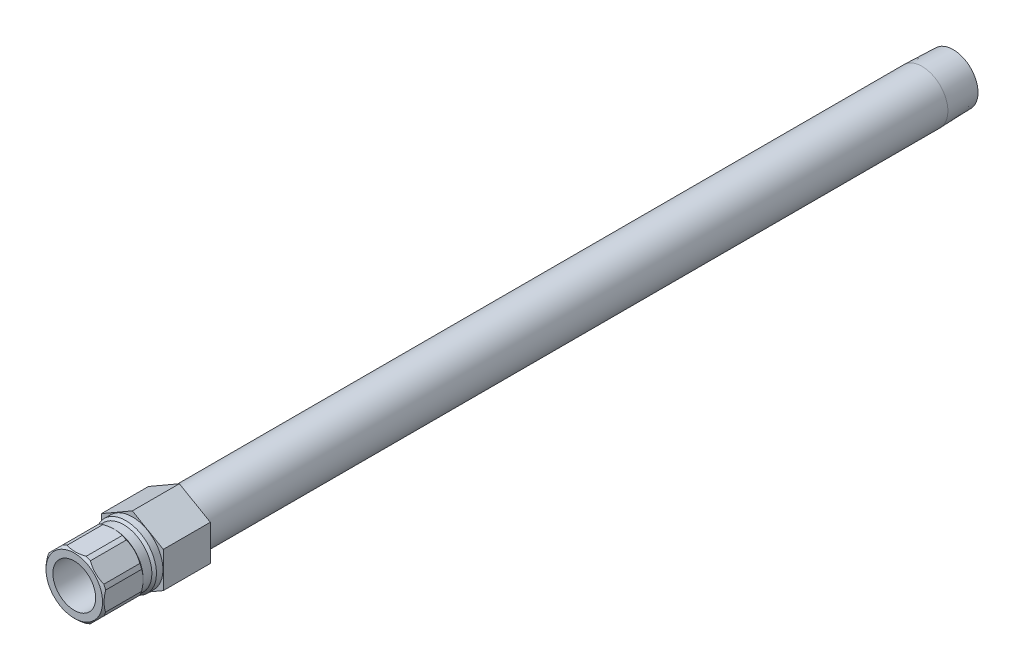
SolidWorks part; units mm, degrees
ref_plane "Front Plane" through (0, 0, 0) normal (0, 0, 1) x (1, 0, 0)
ref_plane "Top Plane" through (0, 0, 0) normal (0, 1, 0) x (1, 0, 0)
ref_plane "Right Plane" through (0, 0, 0) normal (1, 0, 0) x (0, 0, -1)
sketch "Sketch1" plane through (0, 0, 0) normal (1, 0, 0) x (0, 0, -1)
  line L0 (0, 0) -> (-22.479, 0) construction
  line L1 (-19.304, 7.112) -> (-19.304, 9.398)
  line L2 (-5.8166, 9.398) -> (-5.8166, 0) construction
  line L3 (-18.542, 10.16) -> (-6.5786, 10.16)
  line L4 (0, 8.5725) -> (0, 0) construction
  line L5 (-5.8166, 9.398) -> (-2.921, 9.398)
  line L6 (-2.159, 10.16) -> (0, 10.16)
  line L7 (0, 10.16) -> (0, 8.5725)
  line L8 (-5.8166, 9.398) -> (-6.5786, 10.16)
  line L9 (-2.921, 9.398) -> (-2.159, 10.16)
  line L10 (-19.304, 9.398) -> (-18.542, 10.16)
  line L11 (-19.304, 7.112) -> (-1.524, 7.112)
  line L12 (0, 8.5725) -> (262.4582, 8.5725)
  line L13 (262.4582, 8.5725) -> (272.796, 8.2494)
  line L14 (272.796, 8.2494) -> (272.796, 6.2611)
  line L15 (0, 10.16) -> (15.621, 10.16) construction
  line L16 (15.621, 10.16) -> (15.621, 7.112) construction
  line L17 (9.271, 0) -> (0, 0) construction
  line L18 (-1.524, 7.112) -> (-0.6731, 6.2611)
  line L19 (-0.6731, 6.2611) -> (272.796, 6.2611)
  dimension "D1" = 19.304
  dimension "D2" = 2.8956
  dimension "D3" = 0.762
  dimension "D4" = 45
  dimension "D5" = 13.4874
  dimension "D6" = 45
  dimension "D7" = 1.79
  dimension "D8" = 10.3378
  dimension "D9" = 292.1
  dimension "D10" = 3.175
  dimension "D11" = 34.925
  dimension "D12" = 14.224
  dimension "D13" = 17.145
  dimension "D14" = 20.32
  dimension "D15" = 12.5222
  dimension "D16" = 17.78
revolve "Revolve1" add sketch "Sketch1" angle 360 about L0
sketch "Sketch2" plane through (0, 0, 0) normal (0, 0, 1) x (1, 0, 0)
  line L1 (-10.287, 5.9392) -> (-10.287, -5.9392)
  line L2 (-10.287, -5.9392) -> (0, -11.8784)
  line L3 (0, -11.8784) -> (10.287, -5.9392)
  line L4 (10.287, -5.9392) -> (10.287, 5.9392)
  line L5 (10.287, 5.9392) -> (0, 11.8784)
  line L6 (0, 11.8784) -> (-10.287, 5.9392)
  circle A0 centre (0, 0) radius 10.287 construction
  circle A1 centre (0, 0) radius 6.2611 construction
  circle A2 centre (0, 0) radius 6.2611
  dimension "D1" = 20.574
extrude "Boss-Extrude1" add sketch "Sketch2" against normal up to vertex (15.621 mm away) from vertex at 0
sketch "Sketch3" plane through (0, 0, 0) normal (0, 0, 1) x (1, 0, 0)
  line L1 (9.652, -3.998) -> (9.652, 3.998)
  line L2 (9.652, 3.998) -> (3.998, 9.652)
  line L3 (3.998, 9.652) -> (-3.998, 9.652)
  line L4 (-3.998, 9.652) -> (-9.652, 3.998)
  line L5 (-9.652, 3.998) -> (-9.652, -3.998)
  line L6 (-9.652, -3.998) -> (-3.998, -9.652)
  line L7 (-3.998, -9.652) -> (3.998, -9.652)
  line L8 (3.998, -9.652) -> (9.652, -3.998)
  circle A0 centre (0, 0) radius 9.652 construction
  dimension "D1" = 19.304
extrude "Cut-Extrude1" cut sketch "Sketch3" along normal through all from vertex at 5.8166 flip side to cut
